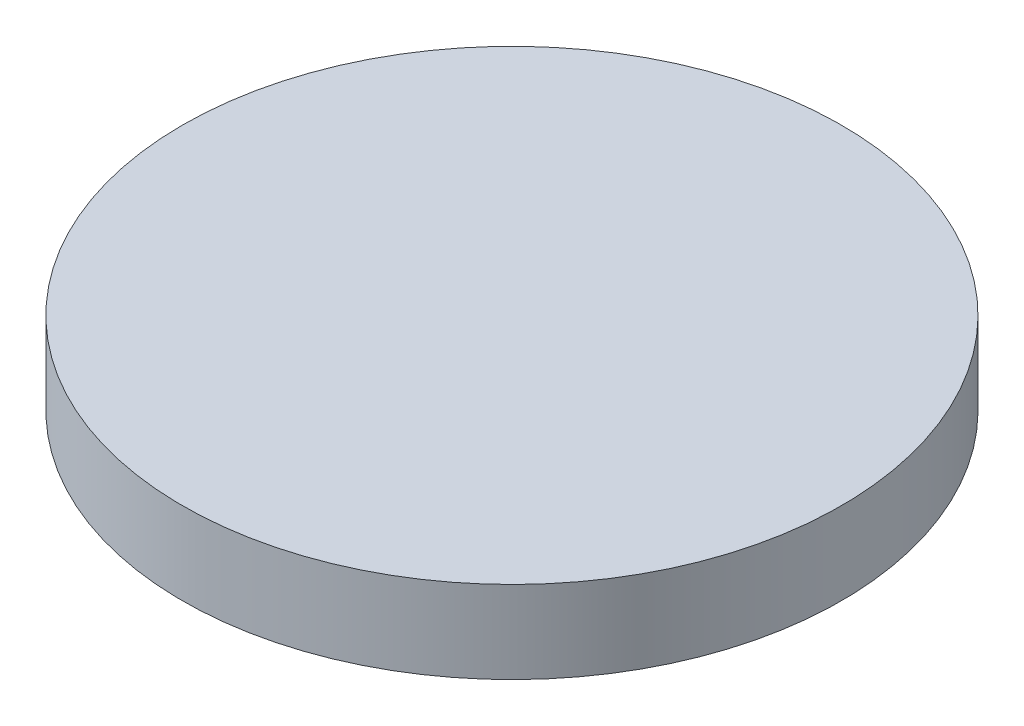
SolidWorks part; units mm, degrees
ref_plane "Front Plane" through (0, 0, 0) normal (0, 0, 1) x (1, 0, 0)
ref_plane "Top Plane" through (0, 0, 0) normal (0, 1, 0) x (1, 0, 0)
ref_plane "Right Plane" through (0, 0, 0) normal (1, 0, 0) x (0, 0, -1)
sketch "Sketch1" plane through (0, 0, 0) normal (0, 0, 1) x (1, 0, 0)
  line L0 (0, 0) -> (0, -16.51) construction
  line L1 (0, -16.51) -> (12.7, -16.51) construction
  line L2 (12.7, -16.51) -> (12.7, 0) construction
  line L3 (12.7, 0) -> (25.4, 0) construction
  line L4 (25.4, 0) -> (25.4, 12.7) construction
  line L5 (0, 0) -> (0, 6.35) construction
  line L6 (25.4, 12.7) -> (25.4, 19.05)
  line L7 (25.4, 19.05) -> (0, 19.05)
  line L8 (0, 19.05) -> (0, 6.35)
  arc A0 (0, 6.35) -> (25.4, 12.7) centre (0, 60.325) ccw
  dimension "D1" = 16.51
  dimension "D2" = 12.7
  dimension "D3" = 12.7
  dimension "D4" = 12.7
  dimension "D5" = 6.35
  dimension "D6" = 6.35
revolve "Revolve1" add sketch "Sketch1" angle 360 about L0
equation "\"D3@Sketch1\" = 1-\"D2@Sketch1\""
